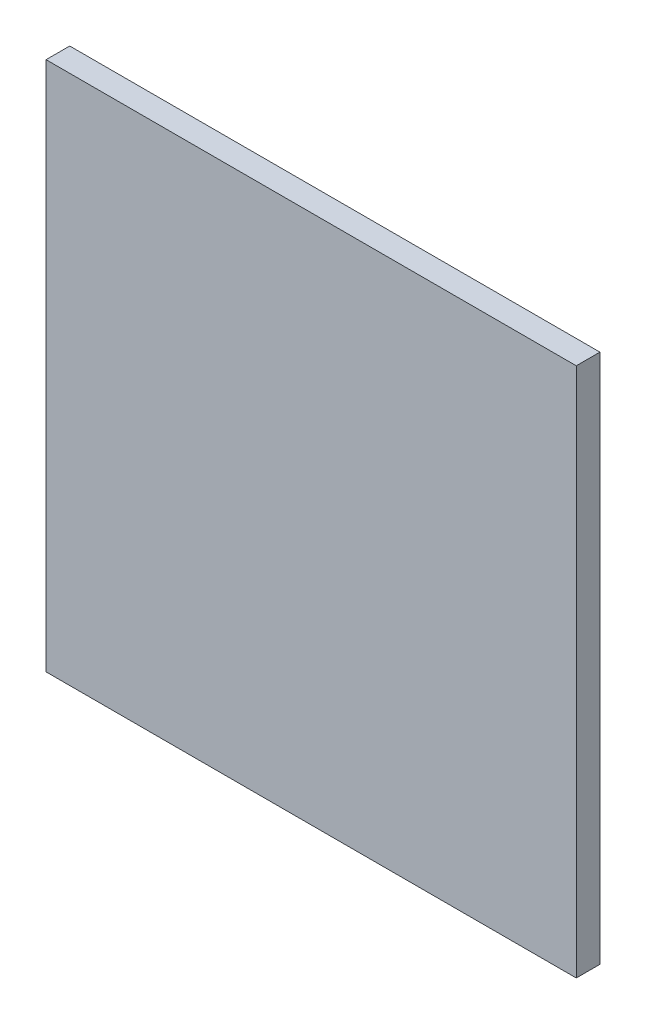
SolidWorks part; units mm, degrees
ref_plane "Front Plane" through (0, 0, 0) normal (0, 0, 1) x (1, 0, 0)
ref_plane "Top Plane" through (0, 0, 0) normal (0, 1, 0) x (1, 0, 0)
ref_plane "Right Plane" through (0, 0, 0) normal (1, 0, 0) x (0, 0, -1)
sketch "Sketch1" plane through (0, 0, 0) normal (0, 0, 1) x (1, 0, 0)
  line L1 (35.56, -35.56) -> (-35.56, -35.56)
  line L2 (35.56, -35.56) -> (35.56, 35.56)
  line L3 (35.56, 35.56) -> (-35.56, 35.56)
  line L4 (-35.56, -35.56) -> (-35.56, 35.56)
  line L5 (35.56, -35.56) -> (-35.56, 35.56) construction
  line L6 (35.56, 35.56) -> (-35.56, -35.56) construction
  point P0 (0, 0)
  dimension "D1" = 71.12
  dimension "D2" = 71.12
extrude "Boss-Extrude1" add sketch "Sketch1" along normal blind 3.175
